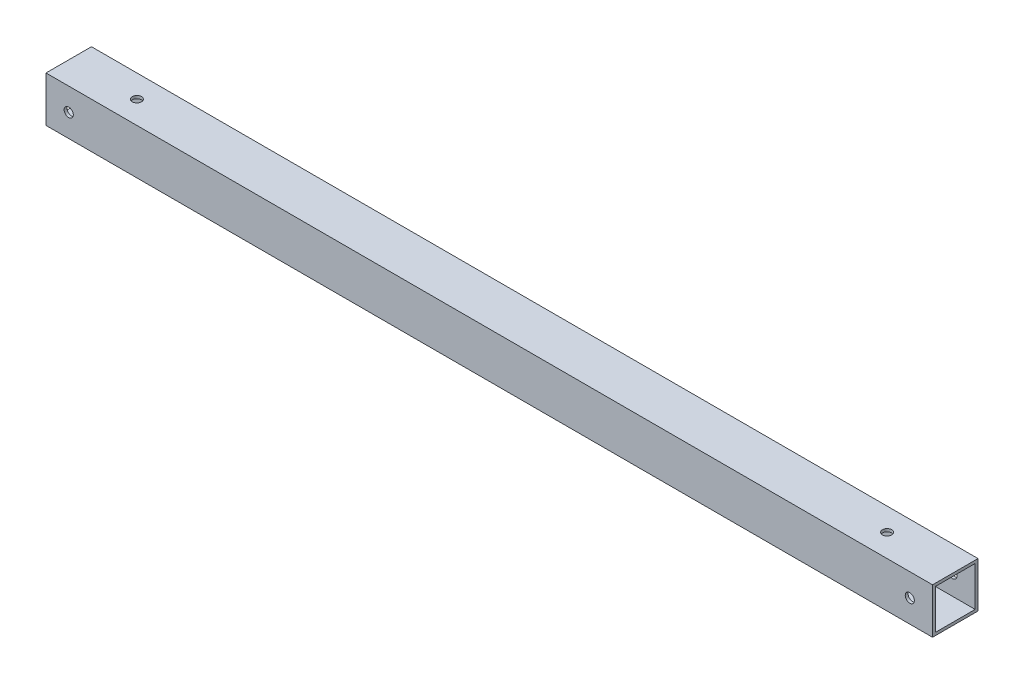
SolidWorks part; units mm, degrees
ref_plane "Front Plane" through (0, 0, 0) normal (0, 0, 1) x (1, 0, 0)
ref_plane "Top Plane" through (0, 0, 0) normal (0, 1, 0) x (1, 0, 0)
ref_plane "Right Plane" through (0, 0, 0) normal (1, 0, 0) x (0, 0, -1)
sketch "Sketch1" plane through (0, 0, 0) normal (1, 0, 0) x (0, 0, -1)
  line L1 (-12.7, -12.7) -> (12.7, -12.7)
  line L2 (-12.7, -12.7) -> (-12.7, 12.7)
  line L3 (-12.7, 12.7) -> (12.7, 12.7)
  line L4 (12.7, -12.7) -> (12.7, 12.7)
  line L5 (-12.7, -12.7) -> (12.7, 12.7) construction
  line L6 (-12.7, 12.7) -> (12.7, -12.7) construction
  line L7 (-11.1125, -11.1125) -> (11.1125, -11.1125)
  line L8 (-11.1125, -11.1125) -> (-11.1125, 11.1125)
  line L9 (-11.1125, 11.1125) -> (11.1125, 11.1125)
  line L10 (11.1125, -11.1125) -> (11.1125, 11.1125)
  line L11 (-11.1125, -11.1125) -> (11.1125, 11.1125) construction
  line L12 (-11.1125, 11.1125) -> (11.1125, -11.1125) construction
  point P0 (0, 0)
  point P6 (0, 0)
  dimension "D1" = 25.4
  dimension "D2" = 1.5875
extrude "Boss-Extrude1" add sketch "Sketch1" along normal blind 495.3
hole_wizard "#7 (0.201) Diameter Hole1" positions "Sketch2" profile "Sketch3" hole size "#7" standard "ANSI Inch"
sketch "Sketch2" plane through (0, 12.7, 0) normal (0, 1, 0) x (1, 0, 0)
  line L0 (0, 12.7) -> (0, -12.7) construction
  line L1 (495.3, 12.7) -> (495.3, -12.7) construction
  point P0 (38.1, 0)
  point P2 (457.2, 0)
  dimension "D1" = 38.1
  dimension "D2" = 38.1
sketch "Sketch3" plane through (38.1, 12.7, 0) normal (1, 0, 0) x (0, 0, 1)
  line L0 (0, 0) -> (0, 25.4)
  line L1 (0, 25.4) -> (2.5527, 25.4)
  line L2 (2.5527, 25.4) -> (2.5527, 0)
  line L5 (2.5527, 0) -> (0, 0)
  line L11 (0, -6.35) -> (0, 107.95) construction
  dimension "Thru Hole Dia." = 5.1054
  dimension "Thru Hole Depth" = 25.4
hole_wizard "#7 (0.201) Diameter Hole2" positions "Sketch5" profile "Sketch6" hole size "#7" standard "ANSI Inch"
sketch "Sketch5" plane through (0, 0, 12.7) normal (0, 0, 1) x (1, 0, 0)
  line L1 (0, 12.7) -> (0, -12.7) construction
  point P0 (482.6, 0)
  point P2 (12.7, 0)
  dimension "D1" = 469.9
  dimension "D2" = 12.7
sketch "Sketch6" plane through (482.6, 0, 12.7) normal (1, 0, 0) x (0, -1, 0)
  line L0 (0, 0) -> (0, 25.4)
  line L1 (0, 25.4) -> (2.5527, 25.4)
  line L2 (2.5527, 25.4) -> (2.5527, 0)
  line L5 (2.5527, 0) -> (0, 0)
  line L11 (0, -6.35) -> (0, 107.95) construction
  dimension "Thru Hole Dia." = 5.1054
  dimension "Thru Hole Depth" = 25.4
